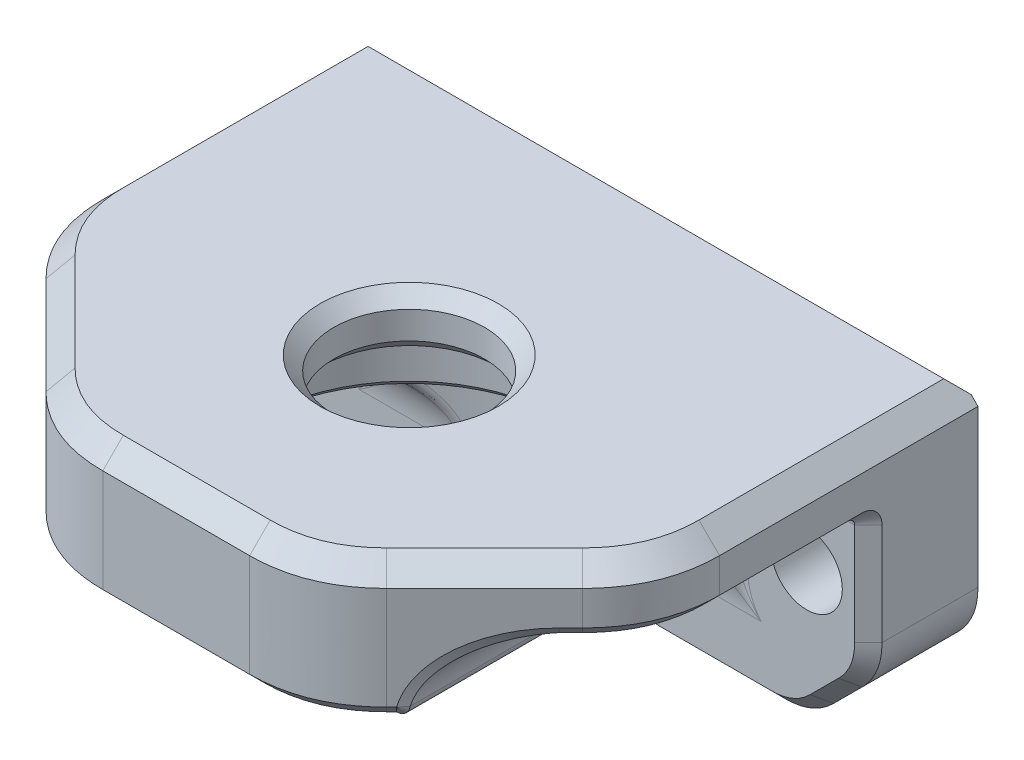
SolidWorks part; units mm, degrees
ref_plane "Front Plane" through (0, 0, 0) normal (0, 0, 1) x (1, 0, 0)
ref_plane "Top Plane" through (0, 0, 0) normal (0, 1, 0) x (1, 0, 0)
ref_plane "Right Plane" through (0, 0, 0) normal (1, 0, 0) x (0, 0, -1)
imported_body "Imported1"
chamfer "Chamfer1" distance 1.5 angle 45
chamfer "Chamfer2" distance 1 angle 45 30 edges at (0, 10, 0) (22.5, 4.8536, 8.1464) (22.5, 0.7855, 8) (22.5, 5, 13.6789) (20, -7.5, 8) (18.7855, 5, 26.7145) (11.32, -10, 8) (6.9438, -10, 7.9636) (3.4744, -10, 6.4729) (-3.4744, -10, 6.4729) (0, 0, 36) (-6.9438, -10, 7.9636) (-11.32, -10, 8) (-20, -7.5, 8) (-18.7855, 5, 26.7145) (-22.5, 0.7855, 8) (-22.5, 4.8536, 8.1464) (-22.5, 5, 13.6789)
sketch "Sketch2" plane through (0, 10, 0) normal (0, -1, 0) x (1, 0, 0)
  arc A0 (0, 12.5) -> (0, 25.5) centre (0, 19) ccw construction
  arc A1 (0, 25.5) -> (0, 12.5) centre (0, 19) ccw construction
  arc A2 (0, 12.5) -> (0, 25.5) centre (0, 19) ccw
  arc A3 (0, 25.5) -> (0, 12.5) centre (0, 19) ccw
extrude "Boss-Extrude1" add sketch "Sketch2" along normal offset from surface (2 mm away) 2
chamfer "Chamfer3" distance 0.5 angle 45 2 edges at (11.1, 0, 19) (-11.1, 0, 19)
chamfer "Chamfer4" [suppressed] distance 0.5 angle 45
sketch "Sketch3" plane through (0, 8, 0) normal (0, -1, 0) x (1, 0, 0)
  arc A2 (0, 24.5) -> (0, 13.5) centre (0, 19) ccw
  arc A3 (0, 13.5) -> (0, 24.5) centre (0, 19) ccw
  arc A4 (0, 24.5) -> (0, 13.5) centre (0, 19) ccw
  arc A5 (0, 13.5) -> (0, 24.5) centre (0, 19) ccw
  dimension "D1" = 0
extrude "Cut-Extrude1" cut sketch "Sketch3" against normal up to surface (2 mm away)
chamfer "Chamfer5" distance 1 angle 45 1 edges at (0, 10, 13.5)
